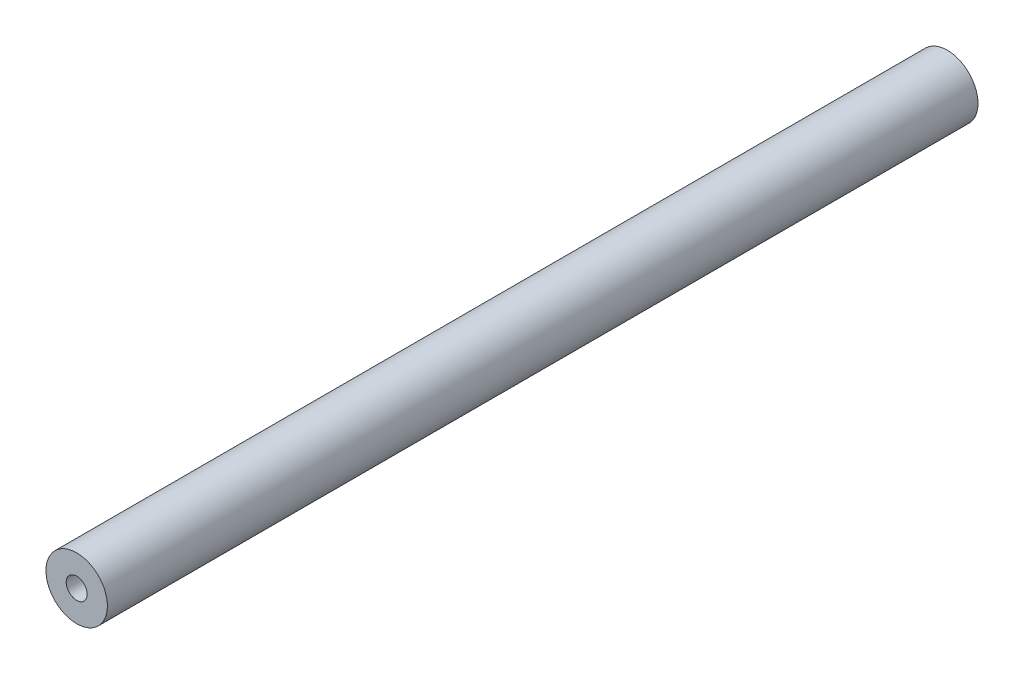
SolidWorks part; units mm, degrees
ref_plane "Plano frontal" through (0, 0, 0) normal (0, 0, 1) x (1, 0, 0)
ref_plane "Plano superior" through (0, 0, 0) normal (0, 1, 0) x (1, 0, 0)
ref_plane "Plano direito" through (0, 0, 0) normal (1, 0, 0) x (0, 0, -1)
sketch "Esboço1" plane through (0, 0, 0) normal (0, 0, 1) x (1, 0, 0)
  circle A0 centre (0, 0) radius 3
  dimension "D1" = 6
extrude "Ressalto-extrusão1" add sketch "Esboço1" along normal blind 85
hole_wizard "Broca de rosquear para tarraxa de M2.51" positions "3DSketch1" profile "Esboço2" hole size "M2.5" standard "ISO"
sketch3d "3DSketch1"
  line L0 (0, 0, 85) -> (0, 0, 0) construction
  point P0 (0, 0, 85)
  point P4 (0, 0, 0)
sketch "Esboço2" plane through (0, 0, 85) normal (1, 0, 0) x (0, -1, 0)
  line L0 (0, 0) -> (0, 8.6159)
  line L1 (0, 8.6159) -> (1.025, 8)
  line L2 (1.025, 8) -> (1.025, 0)
  line L5 (1.025, 0) -> (0, 0)
  line L10 (0, 8.6159) -> (-1.025, 8) construction
  line L11 (0, -6.35) -> (0, 107.95) construction
  dimension "Hole Dia." = 2.05
  dimension "Hole Depth" = 8
  dimension "Drill Angle" = 118
hole_wizard "Broca de rosquear para tarraxa de M2.52" positions "3DSketch2" profile "Esboço3" hole size "M2.5" standard "ISO"
sketch3d "3DSketch2"
  point P0 (0, 0, 0)
sketch "Esboço3" plane through (0, 0, 0) normal (1, 0, 0) x (0, 1, 0)
  line L0 (0, 0) -> (0, 8.6159)
  line L1 (0, 8.6159) -> (1.025, 8)
  line L2 (1.025, 8) -> (1.025, 0)
  line L5 (1.025, 0) -> (0, 0)
  line L10 (0, 8.6159) -> (-1.025, 8) construction
  line L11 (0, -6.35) -> (0, 107.95) construction
  dimension "Hole Dia." = 2.05
  dimension "Hole Depth" = 8
  dimension "Drill Angle" = 118
